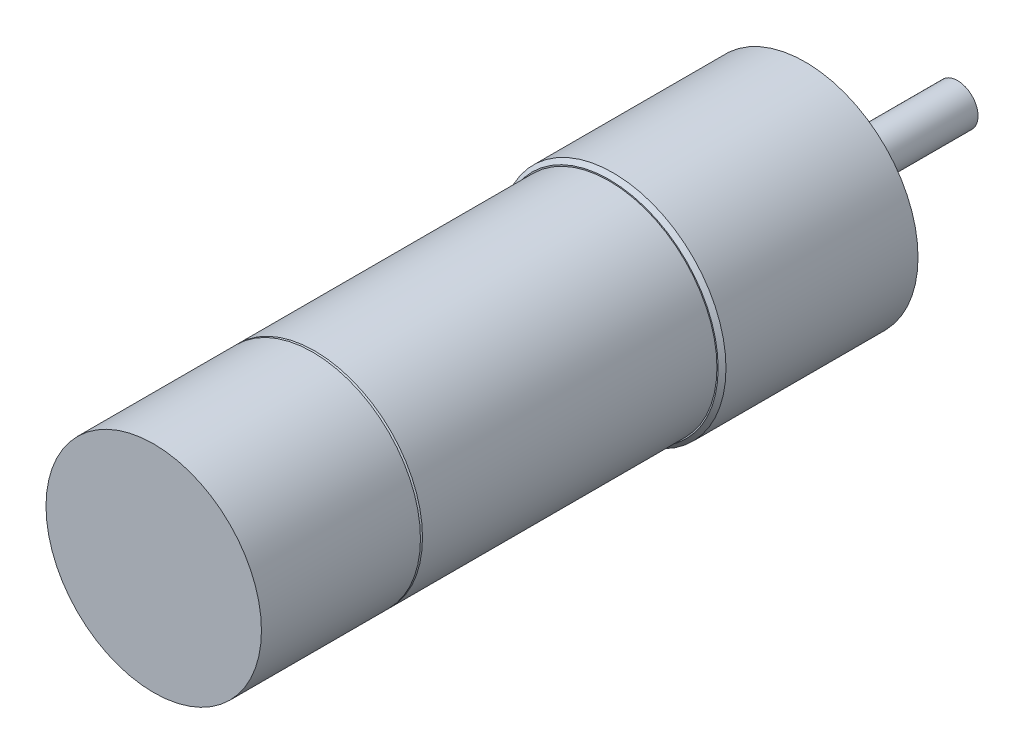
SolidWorks part; units mm, degrees
ref_plane "Front" through (0, 0, 0) normal (0, 0, 1) x (1, 0, 0)
ref_plane "Top" through (0, 0, 0) normal (0, 1, 0) x (1, 0, 0)
ref_plane "Right" through (0, 0, 0) normal (1, 0, 0) x (0, 0, -1)
sketch "Sketch1" plane through (0, 0, 0) normal (0, 0, 1) x (1, 0, 0)
  circle A0 centre (0, 0) radius 11
  dimension "D1" = 22
extrude "Extrude1" add sketch "Sketch1" along normal blind 19.1
chamfer "Chamfer1" distance 0.381 angle 45
sketch "Sketch2" plane through (0, 0, 19.1) normal (0, 0, 1) x (1, 0, 0)
  circle A0 centre (0, 0) radius 10.5
  circle A2 centre (0, 0) radius 11 construction
  dimension "D1" = 21
extrude "Extrude2" add sketch "Sketch2" along normal blind 28.9
sketch "Sketch3" plane through (0, 0, 0) normal (0, 0, -1) x (-1, 0, 0)
  circle A0 centre (0, 0) radius 5
  circle A1 centre (0, 0) radius 11 construction
  dimension "D1" = 10
extrude "Extrude3" add sketch "Sketch3" along normal blind 3.15
sketch "Sketch5" plane through (0, 0, 0) normal (0, 0, -1) x (-1, 0, 0)
  circle A0 centre (0, 0) radius 2
  circle A1 centre (0, 0) radius 11 construction
  dimension "D1" = 4
extrude "Extrude4" add sketch "Sketch5" along normal blind 14.85
chamfer "Chamfer2" distance 0.2 angle 45
sketch "Sketch6" plane through (0, 0, 48) normal (0, 0, 1) x (1, 0, 0)
  circle A0 centre (0, 0) radius 10.5
  circle A1 centre (0, 0) radius 10.5 construction
extrude "Extrude5" add sketch "Sketch6" along normal blind 15.5
sketch "Sketch7" plane through (0, 0, -3.15) normal (0, 0, -1) x (-1, 0, 0)
  circle A0 centre (0, 0) radius 3.5
  circle A1 centre (0, 0) radius 5 construction
  dimension "D1" = 7
extrude "Cut-Extrude1" cut sketch "Sketch7" against normal blind 1.8 flip side to cut
